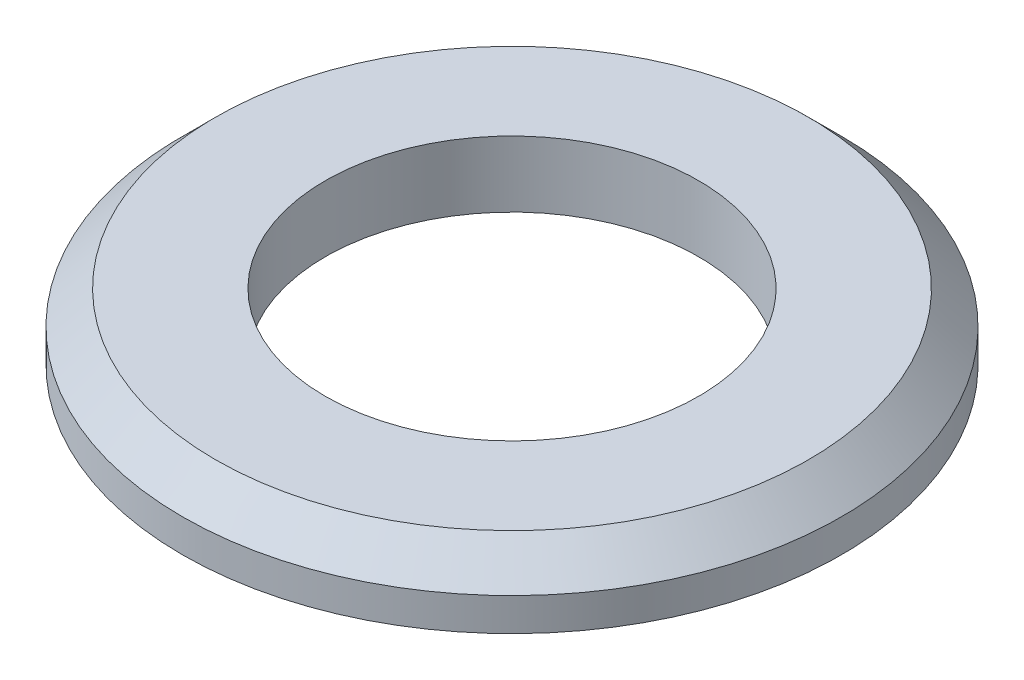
SolidWorks part; units mm, degrees
ref_plane "Front" through (0, 0, 0) normal (0, 0, 1) x (1, 0, 0)
ref_plane "Top" through (0, 0, 0) normal (0, 1, 0) x (1, 0, 0)
ref_plane "Right" through (0, 0, 0) normal (1, 0, 0) x (0, 0, -1)
sketch "Sketch1" plane through (0, 0, 0) normal (0, 1, 0) x (1, 0, 0)
  circle A0 centre (0, 0) radius 8.5
  circle A1 centre (0, 0) radius 15
extrude "Extrude1" add sketch "Sketch1" along normal blind 3
chamfer "Chamfer1" distance 1.5 1 edges at (0, 3, 15)
